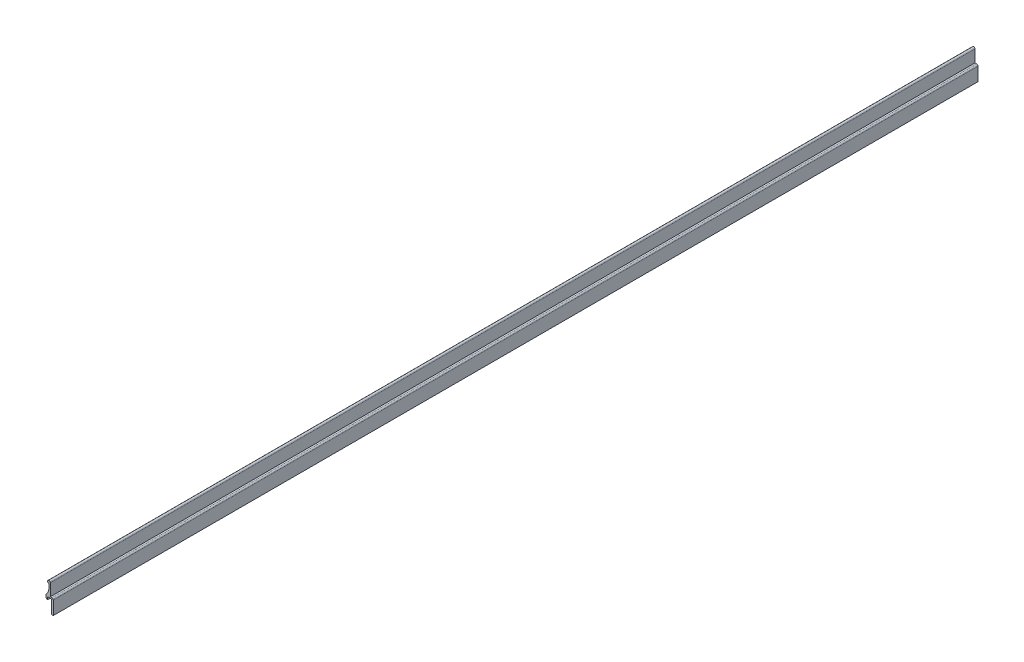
SolidWorks part; units mm, degrees
ref_plane "Plan de face" through (0, 0, 0) normal (0, 0, 1) x (1, 0, 0)
ref_plane "Plan de dessus" through (0, 0, 0) normal (0, 1, 0) x (1, 0, 0)
ref_plane "Plan de droite" through (0, 0, 0) normal (1, 0, 0) x (0, 0, -1)
ref_plane "Plan1" through (0, 0, -687) normal (0, 0, -1) x (-1, 0, 0)
sketch "Esquisse1" plane through (0, 0, -687) normal (0, 0, -1) x (-1, 0, 0)
  line L0 (-2, 10) -> (-2, 1)
  line L1 (-2, 1) -> (-3.2, 1)
  line L2 (-4.2, 0) -> (-4.2, -10)
  line L3 (-4.2, -10) -> (-3, -10)
  line L4 (-3, -10) -> (-3, -0.5)
  line L5 (-2.5, 0) -> (0, 0)
  line L6 (0, 0) -> (-0.15, -1.85)
  line L7 (-0.15, -1.85) -> (0.9689, -1.85)
  line L8 (0.9689, -1.85) -> (1.2, 1)
  line L9 (-1, 6.51) -> (-1, 9)
  arc A0 (-1, 9) -> (-2, 10) centre (-1, 10) ccw
  arc A1 (-3.2, 1) -> (-4.2, 0) centre (-3.2, 0) ccw
  arc A2 (-3, -0.5) -> (-2.5, 0) centre (-2.5, -0.5) cw
  arc A3 (1.2, 1) -> (-1, 6.51) centre (7, 6.51) cw
extrude "Boss.-Extru.1" add sketch "Esquisse1" against normal blind 687
